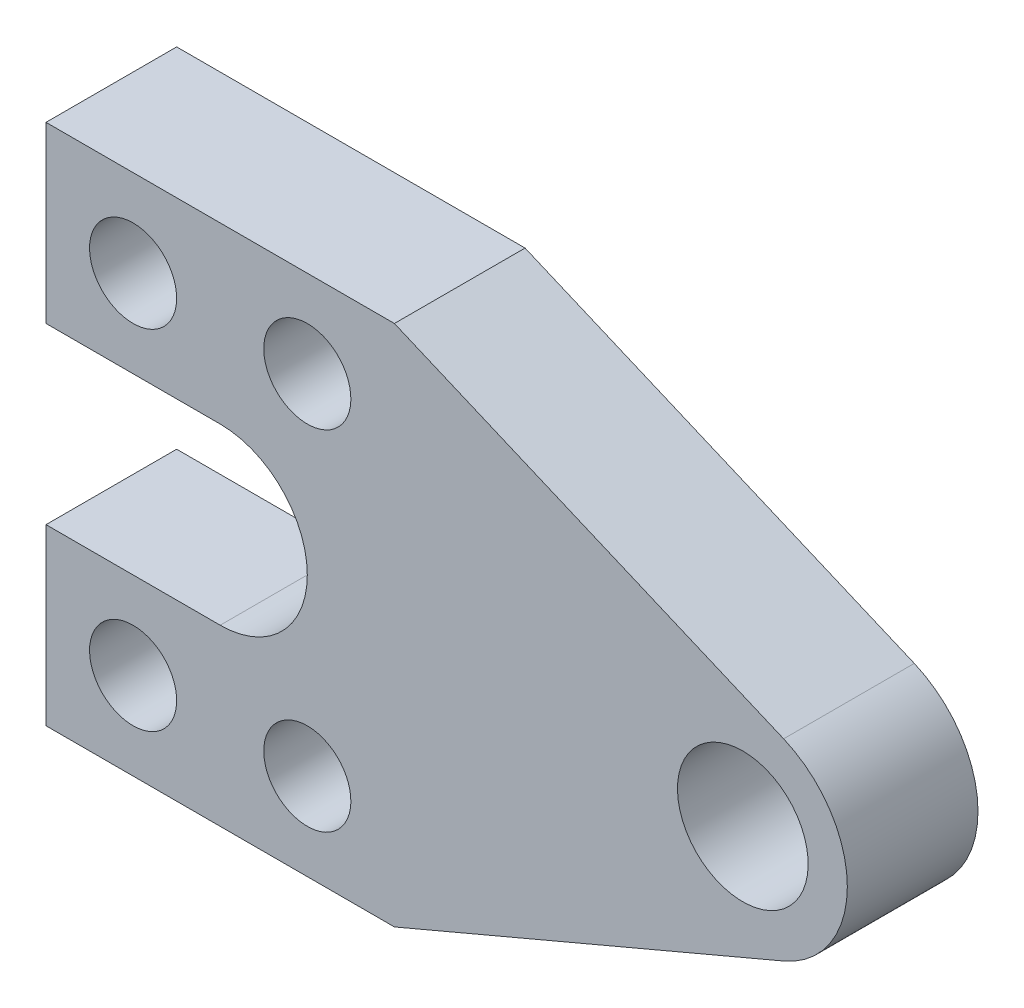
SolidWorks part; units mm, degrees
ref_plane "Front Plane" through (0, 0, 0) normal (0, 0, 1) x (1, 0, 0)
ref_plane "Top Plane" through (0, 0, 0) normal (0, 1, 0) x (1, 0, 0)
ref_plane "Right Plane" through (0, 0, 0) normal (1, 0, 0) x (0, 0, -1)
sketch "Sketch1" plane through (0, 0, 0) normal (0, 0, -1) x (1, 0, 0)
  line L0 (10, 40) -> (116.7127, 40) construction
  line L1 (10, 30) -> (30, 30)
  line L2 (30, 50) -> (10, 50)
  line L3 (10, 50) -> (10, 70)
  line L4 (10, 70) -> (50, 70)
  line L5 (50, 70) -> (94.6856, 51.0474)
  line L6 (94.6856, 28.9526) -> (50, 10)
  line L7 (50, 10) -> (10, 10)
  line L8 (10, 10) -> (10, 30)
  arc A0 (30, 30) -> (30, 50) centre (30, 40) ccw
  arc A1 (94.6856, 51.0474) -> (94.6856, 28.9526) centre (90, 40) cw
  dimension "D3" = 60
  dimension "D2" = 10
  dimension "D5" = 20
  dimension "D4" = 10
  dimension "D6" = 12
  dimension "D1" = 10
  dimension "D7" = 40
  dimension "D8" = 80
extrude "Extrude1" add sketch "Sketch1" along normal mid plane 15
other "Hole1"
sketch "Sketch2" plane through (0, 0, -7.5) normal (0, 0, -1) x (-1, 0, 0)
  line L0 (-50, -70) -> (-10, -70) construction
  line L1 (-10, -70) -> (-10, -50) construction
  circle A0 centre (-20, -60) radius 5
  dimension "D1" = 10
  dimension "D2" = 10
  dimension "D3" = 10
pattern_linear "LPattern1" count 2 spacing 20 along (1, 0, 0) count 2 spacing 40 along (0, 1, 0) of "Hole1"
other "Hole2"
sketch "Sketch3" plane through (0, 0, -7.5) normal (0, 0, -1) x (-1, 0, 0)
  circle A0 centre (-90, -40) radius 7.5
  arc A1 (-94.6856, -28.9526) -> (-94.6856, -51.0474) centre (-90, -40) ccw construction
  dimension "D1" = 15
